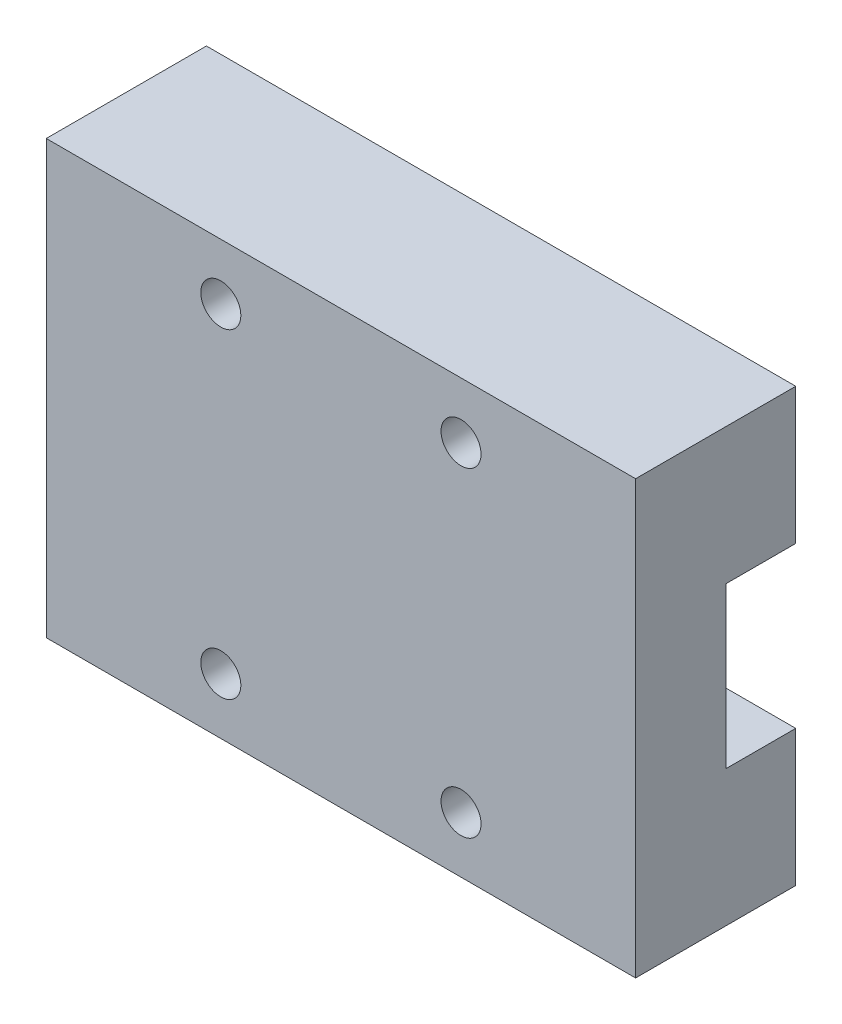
SolidWorks part; units mm, degrees
ref_plane "前视基准面" through (0, 0, 0) normal (0, 0, 1) x (1, 0, 0)
ref_plane "上视基准面" through (0, 0, 0) normal (0, 1, 0) x (1, 0, 0)
ref_plane "右视基准面" through (0, 0, 0) normal (1, 0, 0) x (0, 0, -1)
sketch "草图1" plane through (0, 0, 0) normal (0, 0, 1) x (1, 0, 0)
  line L0 (0, 27) -> (36.8, 27)
  line L1 (0, 0) -> (36.8, 0)
  line L2 (0, 27) -> (0, 0)
  line L3 (36.8, 27) -> (36.8, 0)
  circle A0 centre (10.9, 23.5) radius 1.25
  circle A1 centre (25.9, 23.5) radius 1.25
  circle A2 centre (10.9, 3.5) radius 1.25
  circle A3 centre (25.9, 3.5) radius 1.25
extrude "凸台-拉伸1" add sketch "草图1" along normal blind 10
sketch "草图2" plane through (36.8, 0, 0) normal (1, 0, 0) x (0, 0, -1)
  line L0 (0, 0) -> (0, 27) construction
  line L1 (-4.35, 18.5) -> (3.0376, 18.5)
  line L2 (-4.35, 18.5) -> (-4.35, 8.5)
  line L3 (-4.35, 8.5) -> (3.0376, 8.5)
  line L4 (3.0376, 18.5) -> (3.0376, 8.5)
  line L5 (-10, 13.5) -> (0, 13.5) construction
  line L6 (-10, 0) -> (-10, 27) construction
  dimension "D1" = 10
  dimension "D2" = 4.35
extrude "切除-拉伸1" cut sketch "草图2" against normal through all
